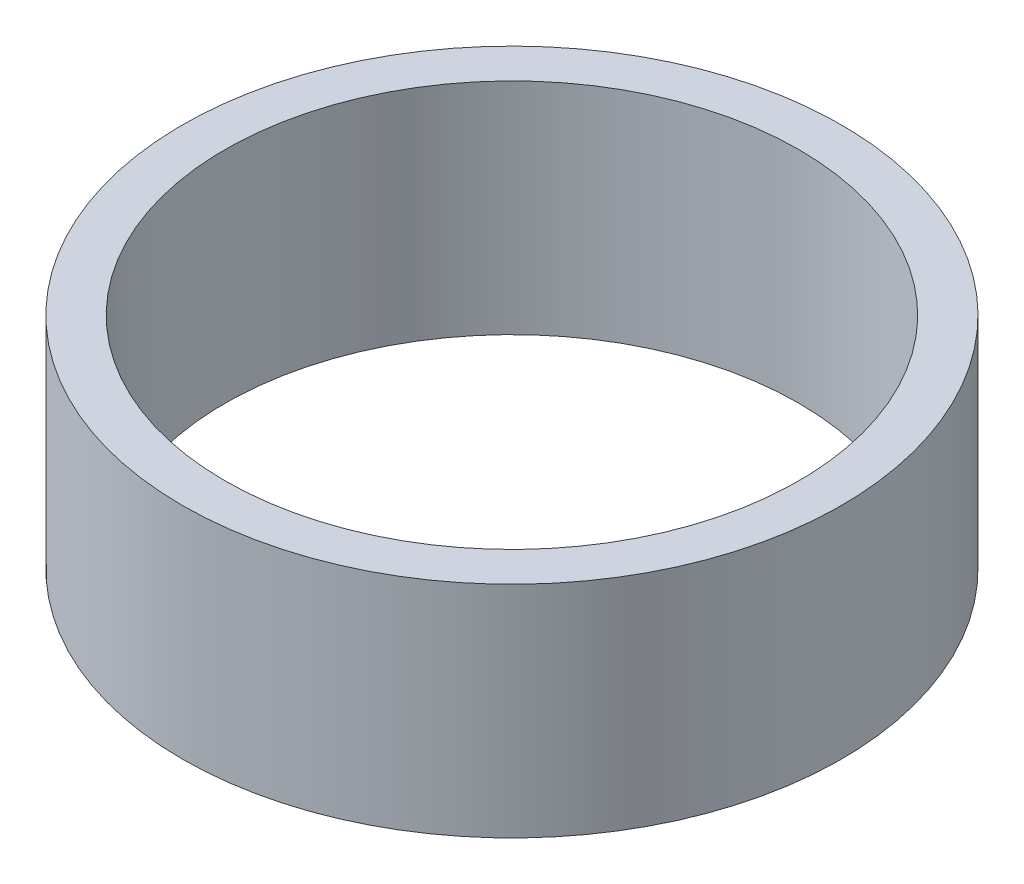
SolidWorks part; units mm, degrees
ref_plane "前基準面" through (0, 0, 0) normal (0, 0, 1) x (1, 0, 0)
ref_plane "上基準面" through (0, 0, 0) normal (0, 1, 0) x (1, 0, 0)
ref_plane "右基準面" through (0, 0, 0) normal (1, 0, 0) x (0, 0, -1)
sketch "草圖2" plane through (0, 0, 0) normal (1, 0, 0) x (0, 0, -1)
  line L0 (0, 4.7551) -> (0, -4.7551) construction
  line L2 (11.1, 0) -> (12.75, 0)
  line L3 (11.1, 0) -> (11.1, -8.5)
  line L4 (11.1, -8.5) -> (12.75, -8.5)
  line L5 (12.75, 0) -> (12.75, -8.5)
  dimension "D1" = 22.2
  dimension "D2" = 8.5
  dimension "D3" = 25.5
revolve "旋轉1" add sketch "草圖2" angle 360 about L0
